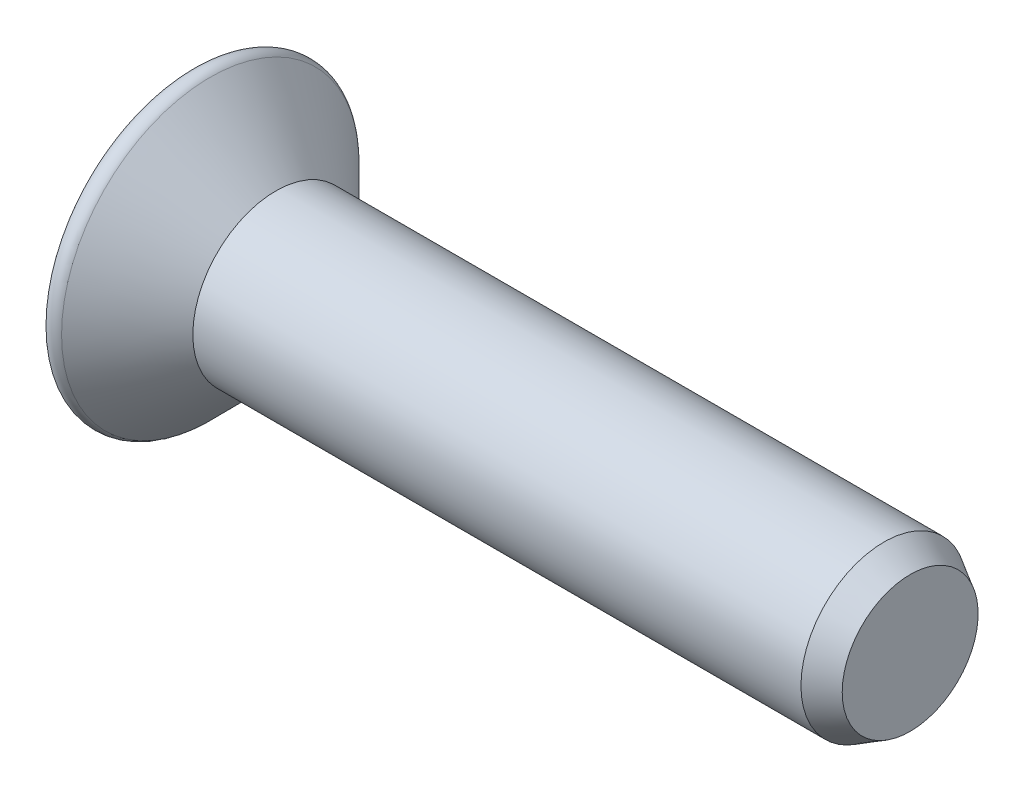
SolidWorks part; units mm, degrees
ref_plane "Front Plane" through (0, 0, 0) normal (0, 0, 1) x (1, 0, 0)
ref_plane "Top Plane" through (0, 0, 0) normal (0, 1, 0) x (1, 0, 0)
ref_plane "Right Plane" through (0, 0, 0) normal (1, 0, 0) x (0, 0, -1)
sketch "Sketch1" plane through (0, 0, 0) normal (0, 0, 1) x (1, 0, 0)
  line L0 (0, 0) -> (6.2784, 0) construction
  line L3 (-1.6, 0) -> (-1.6, -1.8061) construction
  line L4 (-1.6, 0) -> (8.4, 0)
  line L5 (0, 1.1) -> (8.4, 1.1)
  line L6 (8.4, 1.1) -> (8.4, 0)
  line L7 (0, 1.1) -> (-0.869, 1.969)
  arc A0 (-1.1, 1.9365) -> (-1.6, 0) centre (2.4, 0) ccw
  arc A1 (-1.1, 1.9365) -> (-0.869, 1.969) centre (-0.9723, 1.8658) cw
  dimension "D1" = 45
  dimension "rf" = 4
  dimension "l" = 9.5
  dimension "d" = 2.2
  dimension "k" = 1.1
  dimension "f" = 0.5
revolve "Revolve1" add sketch "Sketch1" angle 360 about L0
chamfer "Chamfer1" distance 0.2 angle 60 1 edges at (8.4, 0, 1.1)
sketch "Sketch5" plane through (0, 0, 0) normal (0, 0, 1) x (1, 0, 0)
  line L0 (0.3703, 0.825) -> (0.2069, 0.825)
  line L1 (0.2069, 0.825) -> (0.0481, 1.1)
  line L2 (0.3703, 0.825) -> (0.529, 1.1)
  line L3 (0.0481, 1.1) -> (0.0481, 1.35)
  line L4 (0.529, 1.1) -> (0.529, 1.35)
  line L5 (0.0481, 1.35) -> (0.529, 1.35)
  line L6 (0.2886, 0.825) -> (0.2886, 0) construction
  line L7 (0, 0) -> (7.3035, 0) construction
  line L9 (0, 1.1) -> (0, -1.1) construction
  line L12 (8.0536, 1.1) -> (0, 1.1) construction
  dimension "D2" = 60
  dimension "D3" = 0.25
  dimension "threadstart" = 0.2886
  dimension "minordia" = 1.65
  dimension "advance" = 0.4809
revolve "ThreadSchematic" [suppressed] cut sketch "Sketch5" angle 360 about L7
pattern_linear "ThdSchPat" [suppressed] count 18 spacing 0.4809 along (1, 0, 0)
sketch "Sketch2" plane through (0, 0, 0) normal (0, 0, 1) x (1, 0, 0)
  line L0 (0, 0) -> (5.7679, 0) construction
  line L1 (8.4, 0) -> (6.4947, 1.1)
  line L2 (8.4, 1.1) -> (8.4, 0) construction
  line L4 (6.4947, 1.1) -> (6.4947, 1.2)
  line L5 (6.4947, 1.2) -> (8.5, 1.2)
  line L6 (8.5, 1.2) -> (8.5, 0)
  line L7 (8.5, 0) -> (8.4, 0)
  point P5 (0, 1.1)
  dimension "D1" = 30
  dimension "D2" = 0.1
  dimension "D3" = 0.1
revolve "EndCone" [suppressed] cut sketch "Sketch2" angle 360 about L0
ref_plane "Plane4" through (-1.6, 0, 0) normal (1, 0, 0) x (0, 0, -1)
sketch "Sketch3" plane through (-1.6, 0, 0) normal (1, 0, 0) x (0, 0, -1)
  line L0 (0, 2.343) -> (0, -2.4842) construction
  line L1 (2.7661, 0) -> (-3.4558, 0) construction
  line L2 (-0.22, 1.1) -> (0.22, 1.1)
  line L3 (0.22, 1.1) -> (0.1467, 0.7333)
  line L4 (0, 0) -> (1.9578, 1.9578) construction
  line L5 (0.1467, 0.7333) -> (0.3614, 0.3614)
  line L6 (0.1467, 0.7333) -> (0, 0) construction
  line L7 (-0.1467, 0.7333) -> (-0.3614, 0.3614)
  line L8 (-0.22, 1.1) -> (-0.1467, 0.7333)
  line L9 (1.1, 0.22) -> (1.1, -0.22)
  line L10 (1.1, -0.22) -> (0.7333, -0.1467)
  line L11 (0.7333, -0.1467) -> (0.3614, -0.3614)
  line L12 (0.7333, 0.1467) -> (0.3614, 0.3614)
  line L13 (1.1, 0.22) -> (0.7333, 0.1467)
  line L14 (0.22, -1.1) -> (-0.22, -1.1)
  line L15 (-0.22, -1.1) -> (-0.1467, -0.7333)
  line L16 (-0.1467, -0.7333) -> (-0.3614, -0.3614)
  line L17 (0.1467, -0.7333) -> (0.3614, -0.3614)
  line L18 (0.22, -1.1) -> (0.1467, -0.7333)
  line L19 (-1.1, -0.22) -> (-1.1, 0.22)
  line L20 (-1.1, 0.22) -> (-0.7333, 0.1467)
  line L21 (-0.7333, 0.1467) -> (-0.3614, 0.3614)
  line L22 (-0.7333, -0.1467) -> (-0.3614, -0.3614)
  line L23 (-1.1, -0.22) -> (-0.7333, -0.1467)
  point P14 (0, 1.1)
  point P23 (1.1, 0)
  point P30 (0, -1.1)
  point P37 (-1.1, 0)
  dimension "D1" = 45
  dimension "m" = 2.2
  dimension "D3" = 0.44
  dimension "D4" = 75
  dimension "D5" = 1.4667
extrude "Cut-Extrude1" cut sketch "Sketch3" along normal blind 0.8 draft 6
sketch "Sketch4" plane through (-1.6, 0, 0) normal (1, 0, 0) x (0, 0, -1)
  line L0 (0, 2.1951) -> (0, -2.1951) construction
  line L1 (2.1996, 0) -> (-2.3835, 0) construction
  line L2 (-0.9723, -0.9723) -> (0.9723, 0.9723) construction
  line L3 (1.1, 0.275) -> (-1.1, 0.275)
  line L4 (1.1, 0.275) -> (1.1, -0.275)
  line L5 (1.1, -0.275) -> (-1.1, -0.275)
  line L6 (-1.1, 0.275) -> (-1.1, -0.275)
  line L7 (0.275, 1.1) -> (-0.275, 1.1)
  line L8 (0.275, 1.1) -> (0.275, -1.1)
  line L9 (0.275, -1.1) -> (-0.275, -1.1)
  line L10 (-0.275, 1.1) -> (-0.275, -1.1)
  line L11 (0.9723, 0.9723) -> (0.4468, 0.275)
  line L12 (0.9723, 0.9723) -> (0.275, 0.4468)
  line L13 (0.275, 0.4468) -> (-0.275, 0.4468) construction
  line L14 (0, 0) -> (-0.9723, 0.9723) construction
  line L15 (-0.9723, -0.9723) -> (-0.275, -0.4468)
  line L16 (-0.9723, -0.9723) -> (-0.4468, -0.275)
  line L17 (-0.275, 0.4468) -> (-0.9723, 0.9723)
  line L18 (-0.9723, 0.9723) -> (-0.4468, 0.275)
  line L19 (-0.4468, -0.275) -> (-0.4468, 0.275) construction
  line L20 (0.4468, -0.275) -> (0.9723, -0.9723)
  line L21 (0.9723, -0.9723) -> (0.275, -0.4468)
  circle A0 centre (0, 0) radius 1.375 construction
  dimension "D1" = 2.75
  dimension "D2" = 0.55
  dimension "m" = 2.2
  dimension "D3" = 45
  dimension "D4" = 8
  dimension "D5" = 45
extrude "TypeZ" [suppressed] cut sketch "Sketch4" along normal blind 0.8
equation "\"D1@ThreadCosmetic\" = \"l@Sketch1\" - \"D1@Chamfer1\""
equation "\"minordia@sketch5\" = \"D2@ThreadCosmetic\""
equation "\"D1@Plane4\" = \"K@Sketch1\" + \"f@Sketch1\""
equation "\"D5@Sketch3\" = \"m@Sketch3\" * 2 / 3"
equation "\"D3@Sketch3\" = \"m@Sketch3\" / 5"
equation "\"D1@Cut-Extrude1\" = (  \"K@Sketch1\" + \"f@Sketch1\"  ) / 2"
equation "\"D2@Sketch4\" =  \"m@Sketch4\" / 4"
equation "\"D1@TypeZ\" = (  \"K@Sketch1\"  + \"f@Sketch1\" ) / 2"
equation "\"D1@Sketch4\" = \"m@Sketch4\" * 5 / 4"
equation "\"m@Sketch4\" = \"m@Sketch3\""
equation "\"threadstart@Sketch5\" = \"advance@Sketch5\"*0.6"
equation "\"D1@ThdSchPat\" = int(((\"l@Sketch1\"-\"k@Sketch1\")/\"advance@Sketch5\") + 0.999)"
equation "\"D3@ThdSchPat\" = \"advance@Sketch5\""
